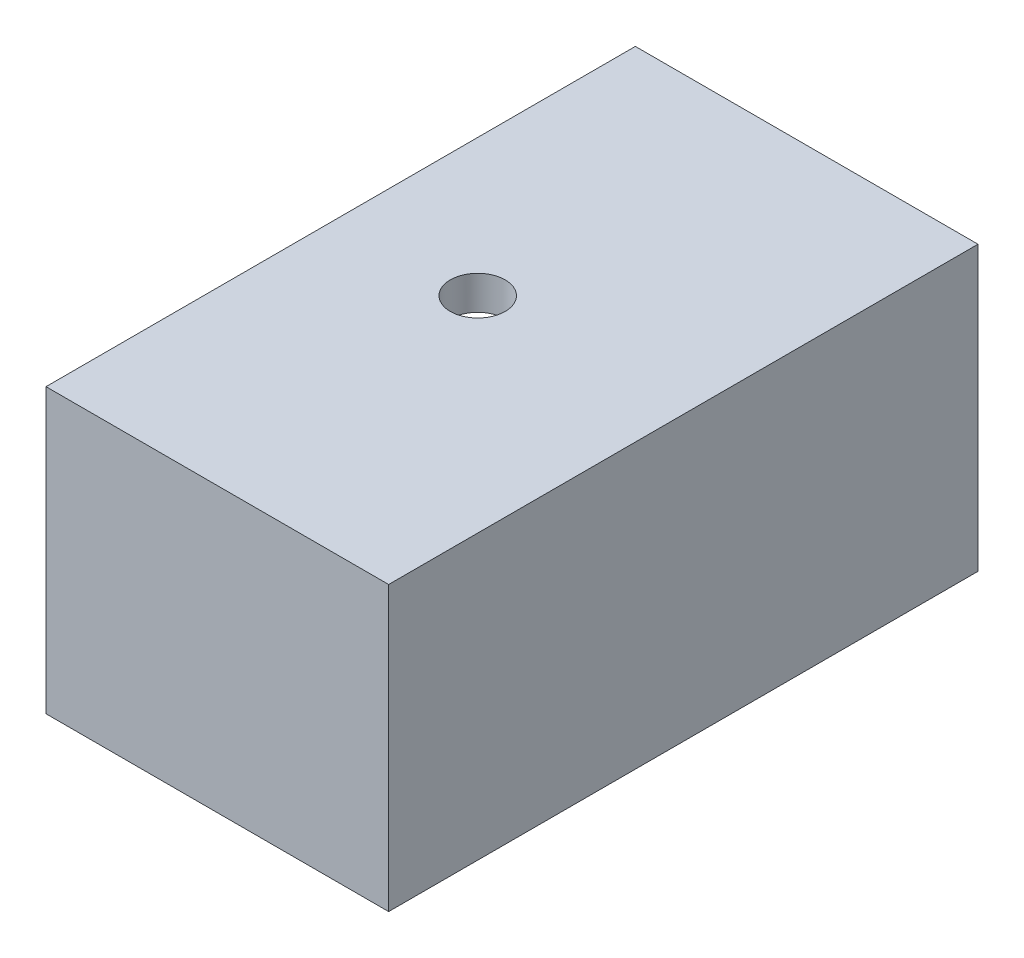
SolidWorks part; units mm, degrees
ref_plane "Front Plane" through (0, 0, 0) normal (0, 0, 1) x (1, 0, 0)
ref_plane "Top Plane" through (0, 0, 0) normal (0, 1, 0) x (1, 0, 0)
ref_plane "Right Plane" through (0, 0, 0) normal (1, 0, 0) x (0, 0, -1)
sketch "Sketch1" plane through (0, 0, 0) normal (0, 1, 0) x (1, 0, 0)
  line L1 (-12.5, -21.5) -> (12.5, -21.5)
  line L2 (-12.5, -21.5) -> (-12.5, 21.5)
  line L3 (-12.5, 21.5) -> (12.5, 21.5)
  line L4 (12.5, -21.5) -> (12.5, 21.5)
  line L5 (-12.5, -21.5) -> (12.5, 21.5) construction
  line L6 (-12.5, 21.5) -> (12.5, -21.5) construction
  point P0 (0, 0)
  dimension "D1" = 43
  dimension "D2" = 25
extrude "Boss-Extrude1" add sketch "Sketch1" along normal blind 20.67
sketch "Sketch2" plane through (-12.5, 0, 0) normal (-1, 0, 0) x (0, 0, 1)
  line L0 (-21.5, 20.67) -> (-21.5, 0) construction
  line L1 (-11.5, 2.4671) -> (11.5, 2.4671)
  line L2 (-11.5, 2.4671) -> (-11.5, 18.2029)
  line L3 (-11.5, 18.2029) -> (11.5, 18.2029)
  line L4 (11.5, 2.4671) -> (11.5, 18.2029)
  line L5 (-11.5, 2.4671) -> (11.5, 18.2029) construction
  line L6 (-11.5, 18.2029) -> (11.5, 2.4671) construction
  line L7 (21.5, 20.67) -> (21.5, 0) construction
  point P0 (0, 10.335)
  dimension "D1" = 10
  dimension "D2" = 10
extrude "Cut-Extrude1" cut sketch "Sketch2" against normal blind 18
sketch "Sketch3" plane through (0, 0, 0) normal (0, -1, 0) x (1, 0, 0)
  line L0 (-12.5, -21.5) -> (-12.5, 21.5) construction
  line L1 (-12.5, 21.5) -> (12.5, 21.5) construction
  circle A0 centre (-2.5, 0) radius 2
  dimension "D1" = 4
  dimension "D2" = 10
  dimension "D3" = 21.5
extrude "Cut-Extrude2" cut sketch "Sketch3" against normal through all
